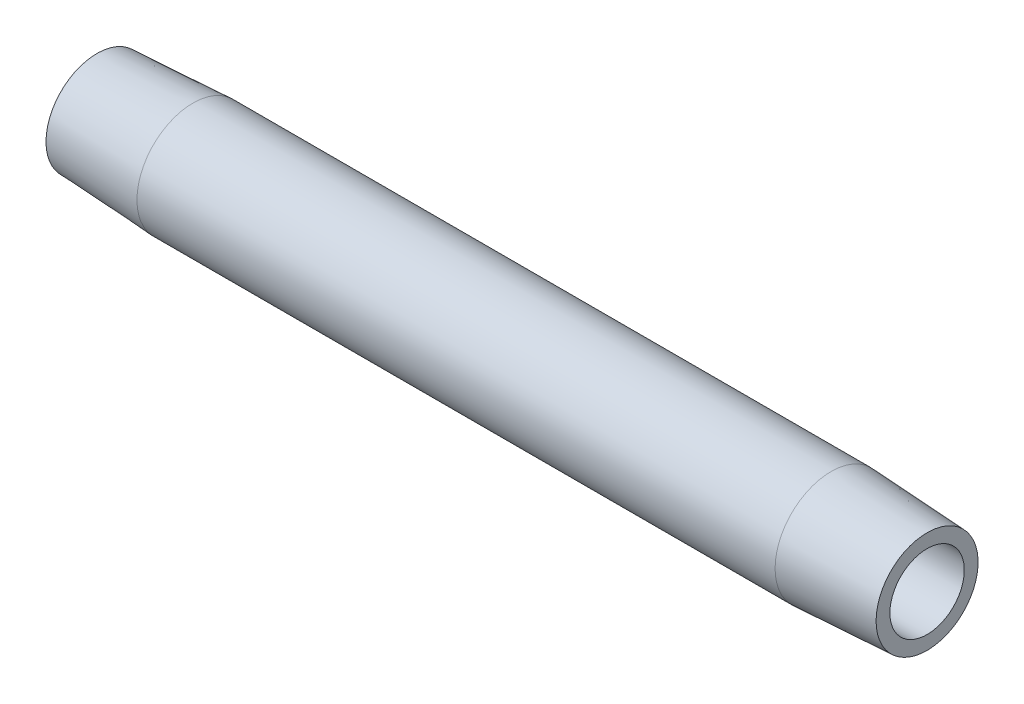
SolidWorks part; units mm, degrees
ref_plane "Front Plane" through (0, 0, 0) normal (0, 0, 1) x (1, 0, 0)
ref_plane "Top Plane" through (0, 0, 0) normal (0, 1, 0) x (1, 0, 0)
ref_plane "Right Plane" through (0, 0, 0) normal (1, 0, 0) x (0, 0, -1)
sketch "Sketch2" plane through (0, 0, 0) normal (0, 0, 1) x (1, 0, 0)
  line L0 (0.4761, 0) -> (50000.4761, 0) construction
  line L1 (0, -11.3625) -> (0, 49988.6375) construction
  line L7 (8.81, 5.1435) -> (0, 4.6818)
  line L8 (67.39, 5.1435) -> (8.81, 5.1435)
  line L9 (76.2, 4.6818) -> (67.39, 5.1435)
  line L10 (76.2, 3.4163) -> (76.2, 4.6818)
  line L11 (76.2, 3.4163) -> (0, 3.4163)
  line L12 (0, 4.6818) -> (0, 3.4163)
  dimension "D1" = 6.8326
  dimension "D2" = 10.287
  dimension "D3" = 3
  dimension "D4" = 3
  dimension "D5" = 8.81
  dimension "D6" = 8.81
  dimension "D7" = 76.2
revolve "Revolve1" add sketch "Sketch2" angle 360 about L0
